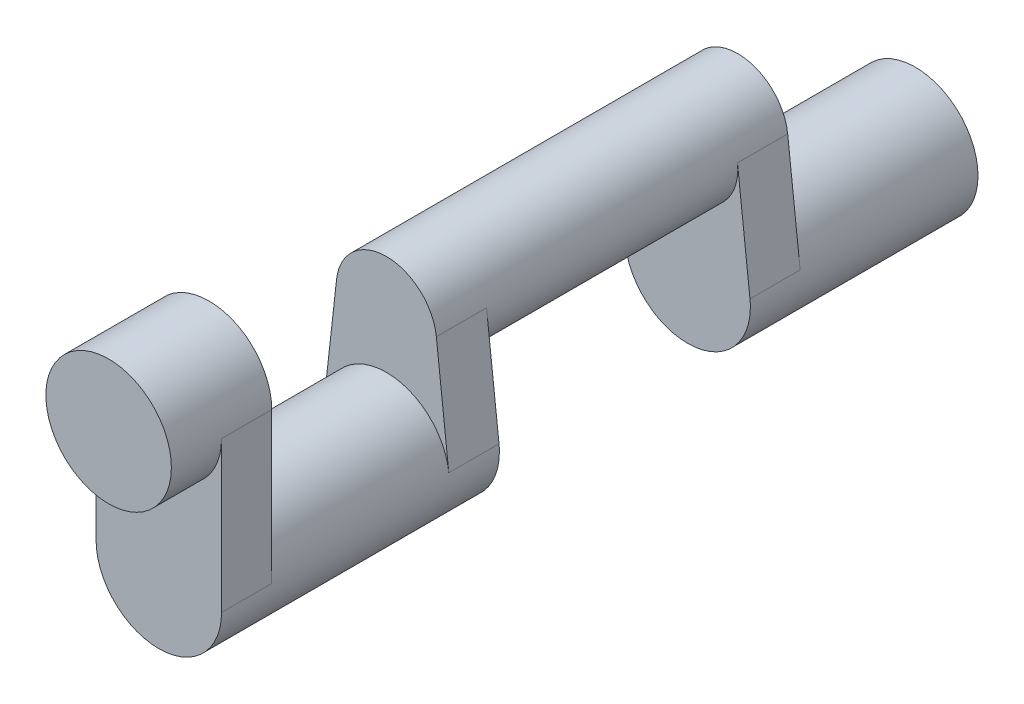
SolidWorks part; units mm, degrees
ref_plane "Front XY" through (0, 0, 0) normal (0, 0, 1) x (1, 0, 0)
ref_plane "Top XZ" through (0, 0, 0) normal (0, 1, 0) x (1, 0, 0)
ref_plane "Right YZ" through (0, 0, 0) normal (1, 0, 0) x (0, 0, -1)
sketch "Sketch1" plane through (0, 0, 0) normal (0, 0, 1) x (1, 0, 0)
  circle A0 centre (0, 0) radius 31.75
  arc A1 (5.5133, -31.2676) -> (-5.5133, 31.2676) centre (0, 0) ccw construction
extrude "Extrude1" add sketch "Sketch1" along normal blind 12.7 and the other way up to surface (77.1019 mm away)
sketch "Sketch2" plane through (0, 0, -77.1019) normal (0, 0, -1) x (-1, 0, 0)
  line L0 (0, 0) -> (0, 57.15) construction
  line L1 (31.5534, 3.5278) -> (25.2427, 59.9722)
  line L2 (-31.5534, 3.5278) -> (-25.2427, 59.9722)
  arc A0 (31.5534, 3.5278) -> (-31.5534, 3.5278) centre (0, 0) cw
  arc A1 (25.2427, 59.9722) -> (-25.2427, 59.9722) centre (0, 57.15) ccw
  circle A2 centre (0, 0) radius 31.75 construction
  arc A3 (5.5133, 31.2676) -> (-5.5133, -31.2676) centre (0, 0) ccw construction
  arc A8 (14.3347, 81.2959) -> (-14.3347, -81.2959) centre (0, 0) ccw
  circle A9 centre (0, 0) radius 82.55 construction
  dimension "D2" = 6.35
  dimension "D1" = 25.4
extrude "Extrude2" add sketch "Sketch2" along normal blind 25.4
sketch "Sketch3" plane through (0, 0, -102.5019) normal (0, 0, -1) x (-1, 0, 0)
  circle A0 centre (0, 57.15) radius 25.4
extrude "Extrude3" add sketch "Sketch3" along normal blind 63.5
mirror "Mirror1" about plane through (0, 57.15, -166.0019) normal (0, 0, -1)
sketch "Sketch4" plane through (0, 0, 12.7) normal (0, 0, 1) x (1, 0, 0)
  line L0 (0, 0) -> (0, 76.2) construction
  line L1 (31.75, 0) -> (31.75, 76.2)
  line L2 (-31.75, 0) -> (-31.75, 76.2)
  arc A0 (31.75, 0) -> (-31.75, 0) centre (0, 0) cw
  arc A1 (31.75, 76.2) -> (-31.75, 76.2) centre (0, 76.2) ccw
  circle A2 centre (0, 0) radius 31.75 construction
  dimension "D3" = 76.2
extrude "Extrude4" add sketch "Sketch4" along normal blind 25.4
sketch "Sketch5" plane through (0, 0, 38.1) normal (0, 0, 1) x (1, 0, 0)
  circle A0 centre (0, 76.2) radius 31.75
extrude "Extrude5" add sketch "Sketch5" along normal blind 25.4
